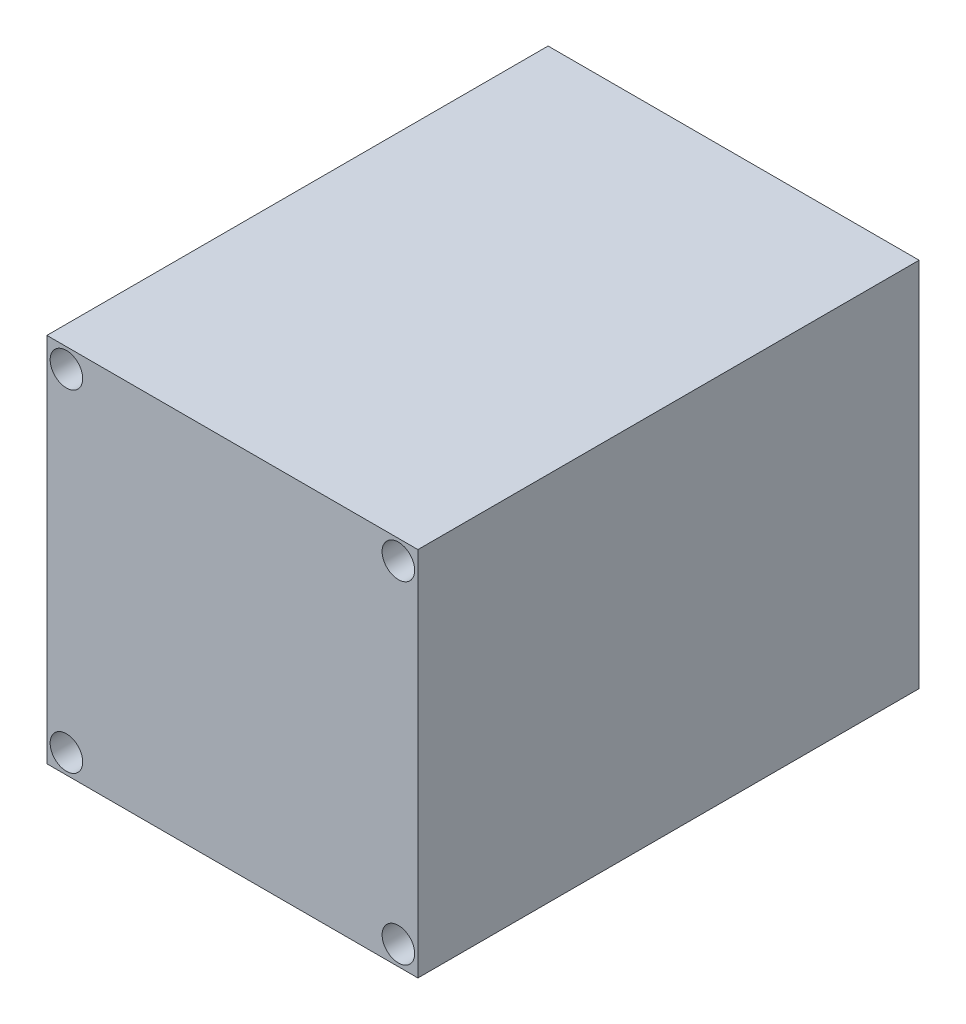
SolidWorks part; units mm, degrees
ref_plane "Front Plane" through (0, 0, 0) normal (0, 0, 1) x (1, 0, 0)
ref_plane "Top Plane" through (0, 0, 0) normal (0, 1, 0) x (1, 0, 0)
ref_plane "Right Plane" through (0, 0, 0) normal (1, 0, 0) x (0, 0, -1)
sketch "Sketch1" plane through (0, 0, 0) normal (0, 0, 1) x (1, 0, 0)
  line L0 (0, -1000) -> (0, 49000) construction
  line L1 (-28.5, 28.5) -> (28.5, 28.5)
  line L2 (-28.5, 28.5) -> (-28.5, -28.5)
  line L3 (-28.5, -28.5) -> (28.5, -28.5)
  line L4 (28.5, 28.5) -> (28.5, -28.5)
  line L5 (-28.5, 28.5) -> (28.5, -28.5) construction
  line L6 (-28.5, -28.5) -> (28.5, 28.5) construction
  line L7 (-1000, 0) -> (49000, 0) construction
  circle A0 centre (-25.5, 25.5) radius 2.5
  circle A1 centre (25.5, 25.5) radius 2.5
  circle A2 centre (25.5, -25.5) radius 2.5
  circle A3 centre (-25.5, -25.5) radius 2.5
  point P0 (0, 0)
  dimension "D2" = 5
  dimension "D1" = 57
  dimension "D3" = 51
extrude "Boss-Extrude1" add sketch "Sketch1" along normal blind 77
sketch "Sketch2" plane through (0, 0, 0) normal (0, 0, -1) x (-1, 0, 0)
  circle A0 centre (0, 0) radius 19
  dimension "D1" = 38
extrude "Boss-Extrude2" add sketch "Sketch2" along normal blind 2
sketch "Sketch3" plane through (0, 0, -2) normal (0, 0, -1) x (-1, 0, 0)
  circle A0 centre (0, 0) radius 3.2
  dimension "D1" = 6.4
extrude "Boss-Extrude3" add sketch "Sketch3" along normal blind 17.3
